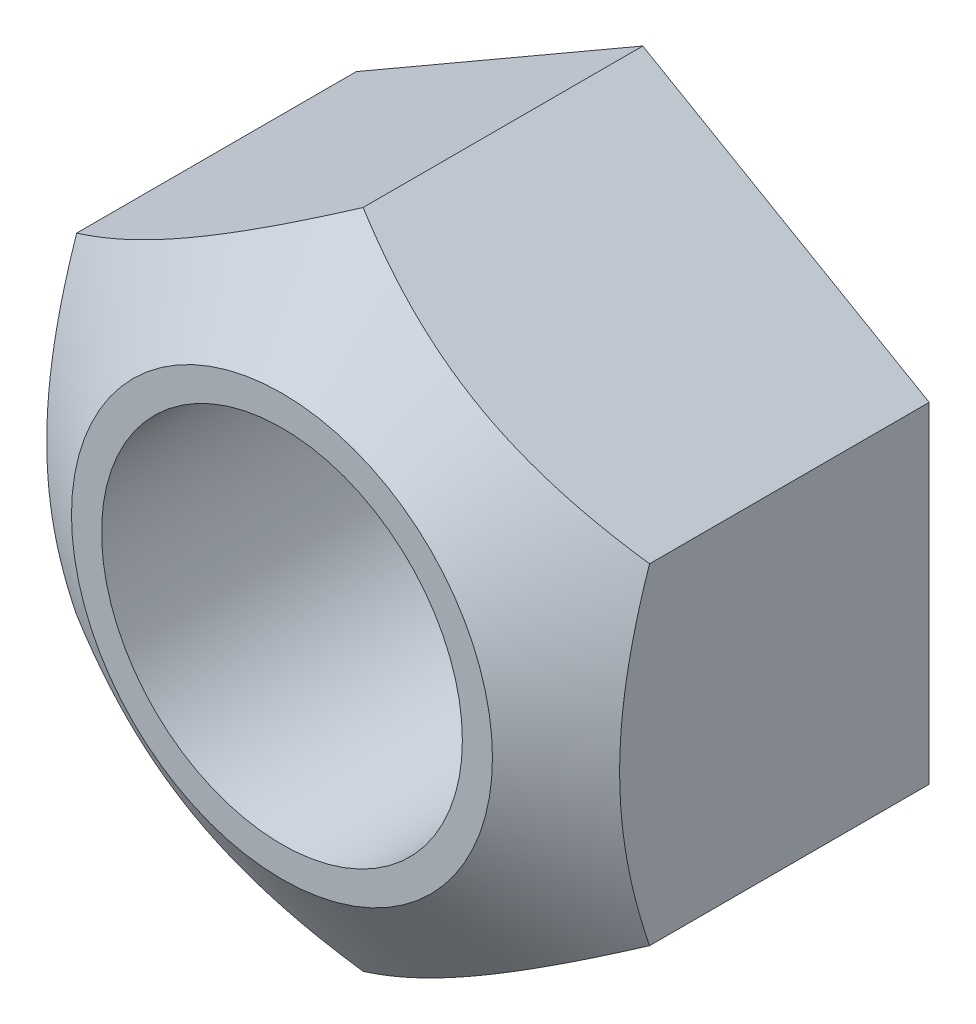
SolidWorks part; units mm, degrees
ref_plane "Face" through (0, 0, 0) normal (0, 0, 1) x (1, 0, 0)
ref_plane "Dessus" through (0, 0, 0) normal (0, 1, 0) x (1, 0, 0)
ref_plane "Droite" through (0, 0, 0) normal (1, 0, 0) x (0, 0, -1)
sketch "Esquisse1" plane through (0, 0, 0) normal (0, 0, 1) x (1, 0, 0)
  line L1 (-4.7631, -2.75) -> (0, -5.5)
  line L2 (0, -5.5) -> (4.7631, -2.75)
  line L3 (4.7631, -2.75) -> (4.7631, 2.75)
  line L4 (4.7631, 2.75) -> (0, 5.5)
  line L5 (0, 5.5) -> (-4.7631, 2.75)
  line L6 (-4.7631, 2.75) -> (-4.7631, -2.75)
  circle A0 centre (0, 0) radius 4.7631 construction
  dimension "D1" = 5.5
extrude "Extrusion1" add sketch "Esquisse1" along normal blind 6
sketch "Esquisse2" plane through (0, 0, 6) normal (0, 0, 1) x (1, 0, 0)
  circle A0 centre (0, 0) radius 3
  dimension "D1" = 6
extrude "Enlèv. mat.-Extru.1" cut sketch "Esquisse2" against normal blind 6
sketch "Esquisse3" plane through (0, 0, 6) normal (0, 0, 1) x (1, 0, 0)
  circle A0 centre (0, 0) radius 3.5
  circle A1 centre (0, 0) radius 10.2401
  dimension "D1" = 7
extrude "Enlèv. mat.-Extru.4" cut sketch "Esquisse3" against normal blind 6 draft 56
